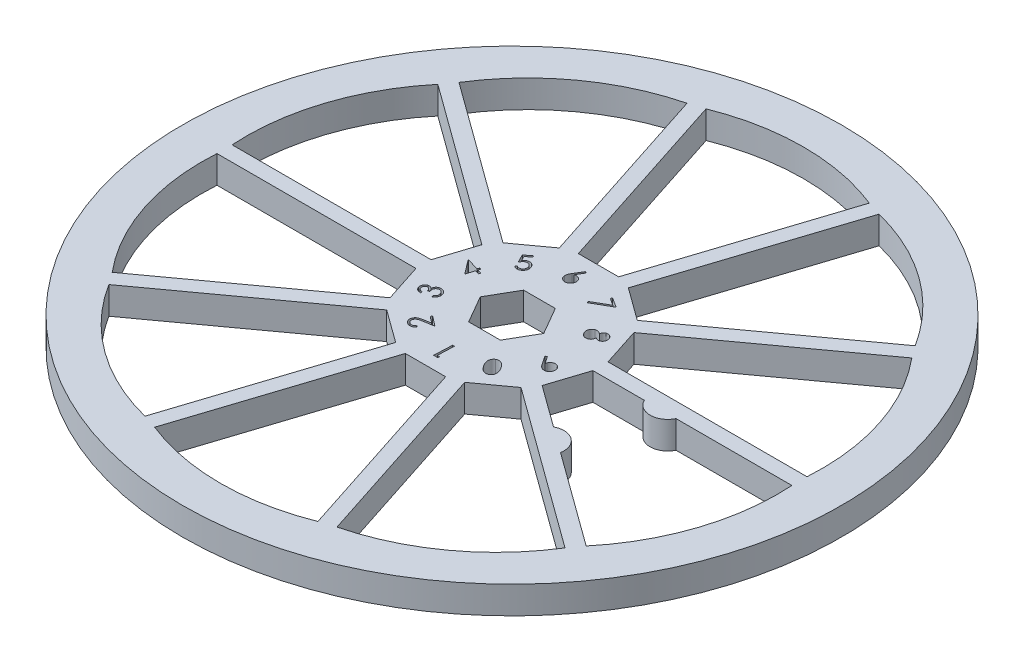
SolidWorks part; units mm, degrees
ref_plane "Front" through (0, 0, 0) normal (0, 0, 1) x (1, 0, 0)
ref_plane "Top" through (0, 0, 0) normal (0, 1, 0) x (1, 0, 0)
ref_plane "Right" through (0, 0, 0) normal (1, 0, 0) x (0, 0, -1)
sketch "Sketch1" plane through (0, 0, 0) normal (0, 1, 0) x (1, 0, 0)
  line L0 (-11.7735, 36.2353) -> (11.7735, -36.2353) construction
  line L1 (30.8235, 22.3946) -> (11.7735, 36.2353) construction
  line L2 (11.7735, 36.2353) -> (-11.7735, 36.2353) construction
  line L3 (-11.7735, 36.2353) -> (-30.8235, 22.3946) construction
  line L4 (-30.8235, 22.3946) -> (-38.1, 0) construction
  line L5 (-38.1, 0) -> (-30.8235, -22.3946) construction
  line L6 (-30.8235, -22.3946) -> (-11.7735, -36.2353) construction
  line L7 (-11.7735, -36.2353) -> (11.7735, -36.2353) construction
  line L8 (11.7735, -36.2353) -> (30.8235, -22.3946) construction
  line L9 (30.8235, -22.3946) -> (38.1, 0) construction
  line L10 (38.1, 0) -> (30.8235, 22.3946) construction
  line L11 (-30.8235, 22.3946) -> (30.8235, -22.3946) construction
  line L12 (38.1, 0) -> (-38.1, 0) construction
  line L13 (11.7735, 36.2353) -> (-11.7735, -36.2353) construction
  line L14 (30.8235, 22.3946) -> (-30.8235, -22.3946) construction
  line L15 (-9.4366, 31.8743) -> (-2.3292, 10)
  line L16 (9.4366, 31.8743) -> (2.3292, 10)
  line L17 (-2.3292, 10) -> (2.3292, 10)
  line L18 (-3.9935, 9.4592) -> (-7.7622, 6.7211)
  line L19 (-26.3696, 20.2402) -> (-7.7622, 6.7211)
  line L20 (-11.1009, 31.3335) -> (-3.9935, 9.4592)
  line L21 (7.7622, 6.7211) -> (3.9935, 9.4592)
  line L22 (11.1009, 31.3335) -> (3.9935, 9.4592)
  line L23 (26.3696, 20.2402) -> (7.7622, 6.7211)
  line L24 (-10.2303, -0.875) -> (-8.7908, -5.3053)
  line L25 (-27.3982, -18.8244) -> (-8.7908, -5.3053)
  line L26 (-33.2303, -0.875) -> (-10.2303, -0.875)
  line L27 (8.7908, -5.3053) -> (10.2303, -0.875)
  line L28 (33.2303, -0.875) -> (10.2303, -0.875)
  line L29 (27.3982, -18.8244) -> (8.7908, -5.3053)
  line L30 (-2.3292, -10) -> (2.3292, -10)
  line L31 (9.4366, -31.8743) -> (2.3292, -10)
  line L32 (-9.4366, -31.8743) -> (-2.3292, -10)
  line L33 (-27.3982, 18.8244) -> (-8.7908, 5.3053)
  line L34 (-33.2303, 0.875) -> (-10.2303, 0.875)
  line L35 (-10.2303, 0.875) -> (-8.7908, 5.3053)
  line L36 (-3.9935, -9.4592) -> (-7.7622, -6.7211)
  line L37 (-26.3696, -20.2402) -> (-7.7622, -6.7211)
  line L38 (-11.1009, -31.3335) -> (-3.9935, -9.4592)
  line L39 (8.7908, 5.3053) -> (10.2303, 0.875)
  line L40 (27.3982, 18.8244) -> (8.7908, 5.3053)
  line L41 (33.2303, 0.875) -> (10.2303, 0.875)
  line L42 (7.7622, -6.7211) -> (3.9935, -9.4592)
  line L43 (26.3696, -20.2402) -> (7.7622, -6.7211)
  line L44 (11.1009, -31.3335) -> (3.9935, -9.4592)
  line L46 (3.6662, 0) -> (1.8331, 3.175)
  line L47 (1.8331, 3.175) -> (-1.8331, 3.175)
  line L48 (-1.8331, 3.175) -> (-3.6662, 0)
  line L49 (-3.6662, 0) -> (-1.8331, -3.175)
  line L50 (-1.8331, -3.175) -> (1.8331, -3.175)
  line L51 (1.8331, -3.175) -> (3.6662, 0)
  circle A0 centre (0, 0) radius 38.1
  arc A1 (-9.4366, 31.8743) -> (9.4366, 31.8743) centre (0, 8.2923) cw
  arc A2 (-11.1009, 31.3335) -> (-26.3696, 20.2402) centre (-4.8741, 6.7086) ccw
  arc A3 (26.3696, 20.2402) -> (11.1009, 31.3335) centre (4.8741, 6.7086) ccw
  arc A4 (-33.2303, -0.875) -> (-27.3982, -18.8244) centre (-7.8864, -2.5625) ccw
  arc A5 (27.3982, -18.8244) -> (33.2303, -0.875) centre (7.8864, -2.5625) ccw
  arc A6 (-9.4366, -31.8743) -> (9.4366, -31.8743) centre (0, -8.2923) ccw
  arc A7 (-33.2303, 0.875) -> (-27.3982, 18.8244) centre (-7.8864, 2.5625) cw
  arc A8 (-11.1009, -31.3335) -> (-26.3696, -20.2402) centre (-4.8741, -6.7086) cw
  arc A9 (27.3982, 18.8244) -> (33.2303, 0.875) centre (7.8864, 2.5625) cw
  arc A10 (26.3696, -20.2402) -> (11.1009, -31.3335) centre (4.8741, -6.7086) cw
  circle A11 centre (18, 0) radius 0.35 construction
  circle A12 centre (14.5623, -10.5801) radius 0.35 construction
  circle A13 centre (0, 0) radius 3.175 construction
  dimension "D2" = 23
  dimension "D1" = 76.2
  dimension "D6" = 25.4
  dimension "D7" = 0.7
  dimension "D3" = 1.75
  dimension "D4" = 1.75
  dimension "D5" = 10
  dimension "D8" = 18
  dimension "D9" = 18
  dimension "D10" = 6.35
extrude "Boss-Extrude1" add sketch "Sketch1" along normal blind 3.175
sketch "Sketch4" plane through (0, 3.175, 0) normal (0, 1, 0) x (1, 0, 0)
  circle A0 centre (0, 0) radius 6.5 construction
  text T0 "8     7     6     5     4     3     2     1     0     9" font "Century Gothic" height in points 8
  dimension "D1" = 13
extrude "Cut-Extrude1" cut sketch "Sketch4" against normal through all
sketch "Sketch6" plane through (0, 0, 0) normal (0, 1, 0) x (1, 0, 0)
  line L0 (16.166, -0.875) -> (19.834, -0.875)
  line L1 (13.5929, -8.7943) -> (16.5603, -10.9502)
  line L2 (27.3982, -18.8244) -> (8.7908, -5.3053) construction
  line L3 (33.2303, -0.875) -> (10.2303, -0.875) construction
  arc A0 (19.834, -0.875) -> (16.166, -0.875) centre (18, 0) cw
  arc A1 (13.5929, -8.7943) -> (16.5603, -10.9502) centre (14.5623, -10.5801) cw
  dimension "D1" = 2.032
extrude "Boss-Extrude3" add sketch "Sketch6" along normal blind 3.175
